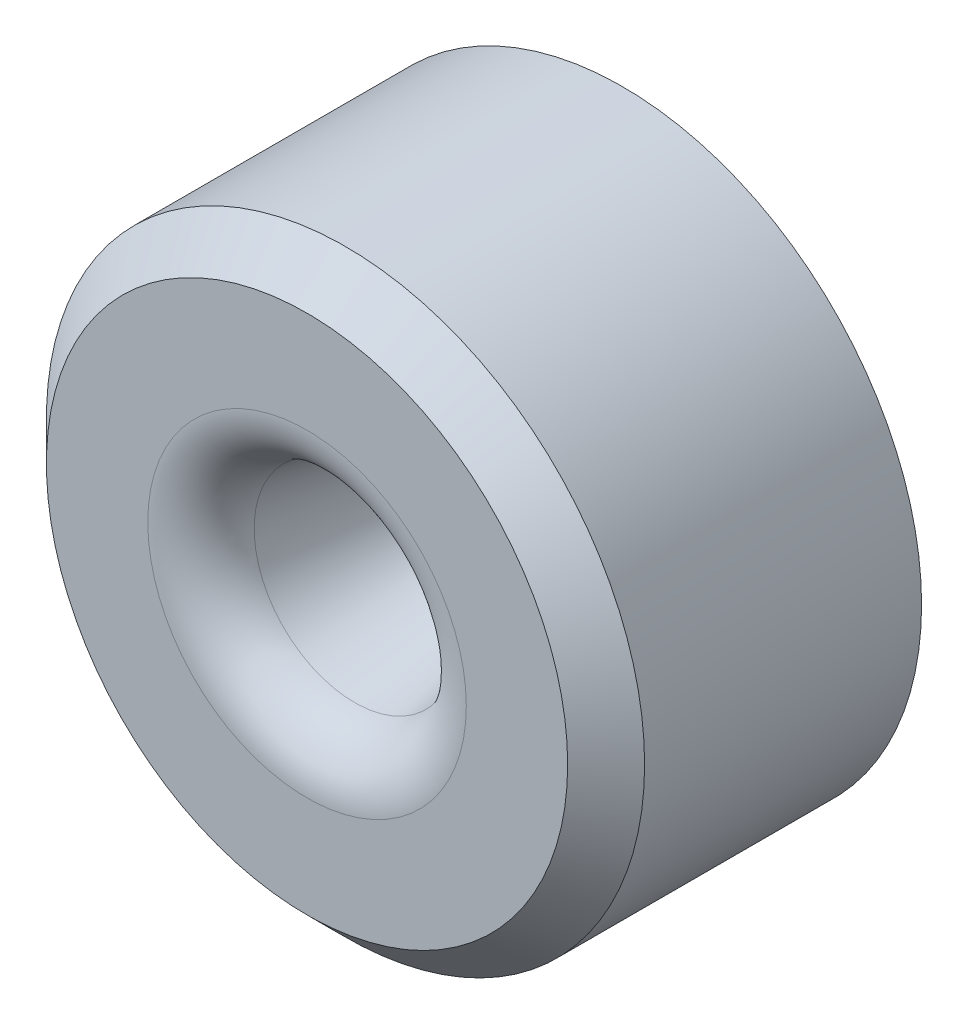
SolidWorks part; units mm, degrees
ref_plane "Спереди" through (0, 0, 0) normal (0, 0, 1) x (1, 0, 0)
ref_plane "Сверху" through (0, 0, 0) normal (0, 1, 0) x (1, 0, 0)
ref_plane "Справа" through (0, 0, 0) normal (1, 0, 0) x (0, 0, -1)
sketch "Эскиз1" plane through (0, 0, 0) normal (1, 0, 0) x (0, 0, -1)
  line L0 (0, 0) -> (25.8409, 0) construction
  line L1 (0, 2.1033) -> (0, 3.4417)
  line L2 (0, 3.4417) -> (0.508, 3.9497)
  line L3 (0.508, 3.9497) -> (4.1656, 3.9497)
  line L4 (4.1656, 3.9497) -> (4.1656, 0.9779)
  line L5 (4.1656, 0.9779) -> (2.2705, 0.9779)
  line L6 (2.2705, 0.9779) -> (0.6287, 1.3269)
  arc A0 (0, 2.1033) -> (0.6287, 1.3269) centre (0.7937, 2.1033) ccw
  point P11 (0, 1.4605)
  dimension "D8" = 0.7937
  dimension "D1" = 1.9558
  dimension "D2" = 2.921
  dimension "D3" = 45
  dimension "D4" = 4.1656
  dimension "D5" = 0.508
  dimension "D6" = 12
  dimension "D7" = 7.8994
revolve "Повернуть1" add sketch "Эскиз1" angle 360 about L0
